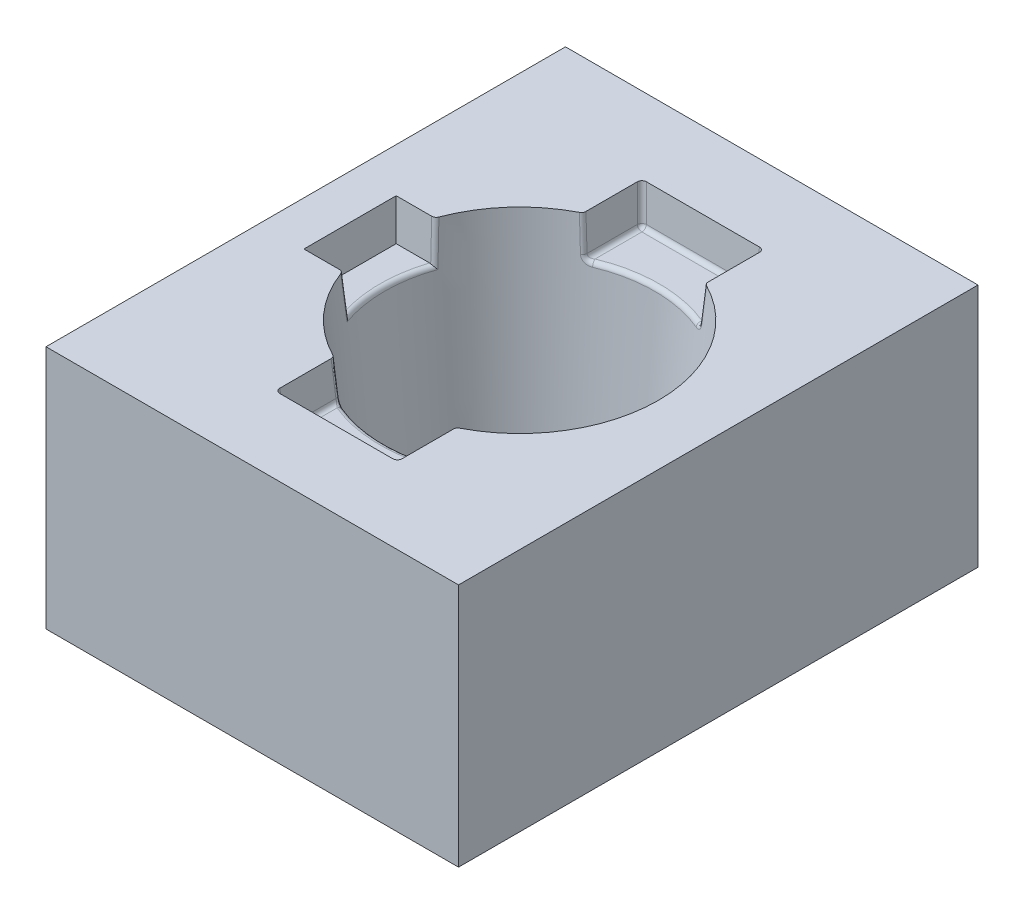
SolidWorks part; units mm, degrees
ref_plane "Plan de face" through (0, 0, 0) normal (0, 0, 1) x (1, 0, 0)
ref_plane "Plan de dessus" through (0, 0, 0) normal (0, 1, 0) x (1, 0, 0)
ref_plane "Plan de droite" through (0, 0, 0) normal (1, 0, 0) x (0, 0, -1)
ref_plane "Plan4" through (0, 52.9277, 0) normal (0, 1, 0) x (-1, 0, 0)
sketch "Esquisse3" plane through (0, 52.9277, 0) normal (0, 1, 0) x (-1, 0, 0)
  line L1 (-116.2406, 170) -> (153.7594, 170)
  line L2 (-116.2406, 170) -> (-116.2406, -170)
  line L3 (-116.2406, -170) -> (153.7594, -170)
  line L4 (153.7594, 170) -> (153.7594, -170)
  dimension "D1" = 170
  dimension "D2" = 170
  dimension "D3" = 140
  dimension "D4" = 130
extrude "Extrusion1" add sketch "Esquisse3" against normal blind 160
other "Empreinte1"
other "modèle<1>@moyeu de roue1"
